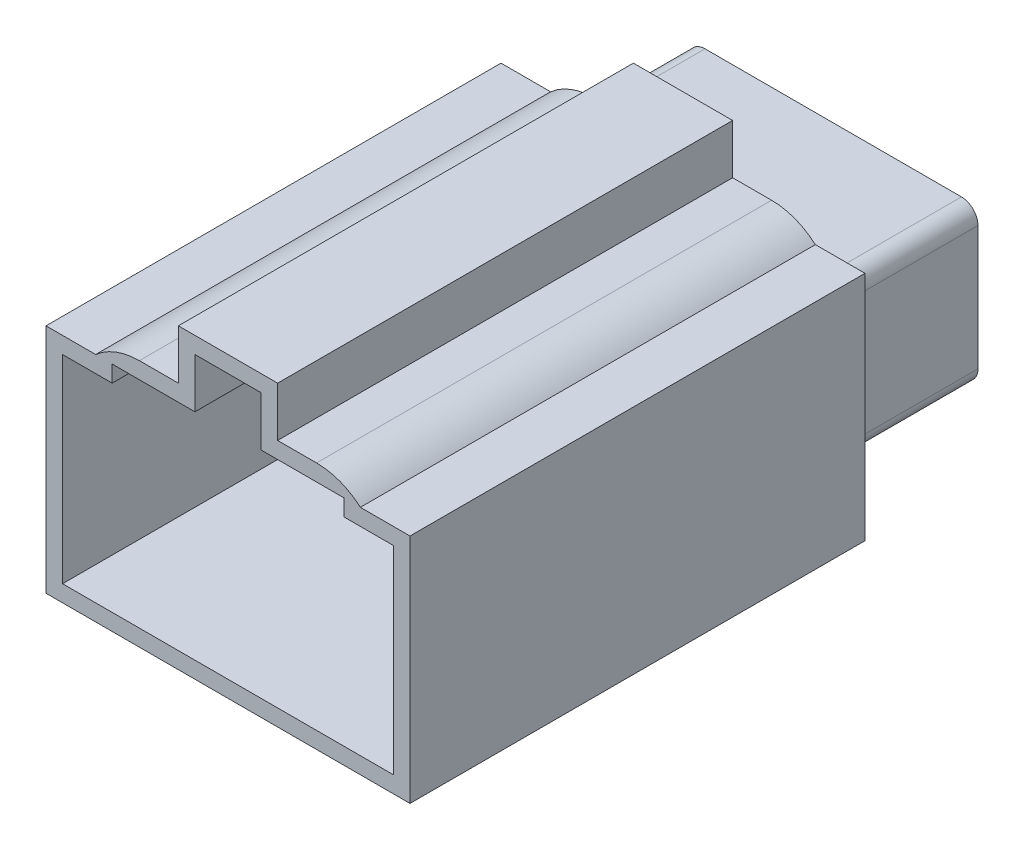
SolidWorks part; units mm, degrees
ref_plane "Front Plane" through (0, 0, 0) normal (0, 0, 1) x (1, 0, 0)
ref_plane "Top Plane" through (0, 0, 0) normal (0, 1, 0) x (1, 0, 0)
ref_plane "Right Plane" through (0, 0, 0) normal (1, 0, 0) x (0, 0, -1)
sketch "Sketch1" plane through (0, 0, 0) normal (0, 0, 1) x (1, 0, 0)
  line L0 (9.75, -11.1213) -> (-12.25, -11.1213)
  line L1 (-12.25, -11.1213) -> (-12.25, 2.8787)
  line L2 (-12.25, 2.8787) -> (-9.25, 2.8787)
  line L3 (-9.25, 2.8787) -> (-9.25, 3.8787)
  line L4 (-9.25, 3.8787) -> (-4.25, 3.8787)
  line L5 (-4.25, 3.8787) -> (-4.25, 6.8787)
  line L6 (-4.25, 6.8787) -> (1.75, 6.8787)
  line L7 (8.75, -10.1213) -> (-11.25, -10.1213)
  line L8 (1.75, 3.8787) -> (1.75, 6.8787)
  line L9 (6.75, 3.8787) -> (1.75, 3.8787)
  line L10 (6.75, 2.8787) -> (6.75, 3.8787)
  line L11 (9.75, 2.8787) -> (6.75, 2.8787)
  line L12 (9.75, -11.1213) -> (9.75, 2.8787)
  line L13 (-11.25, -10.1213) -> (-11.25, 1.8787)
  line L14 (-11.25, 1.8787) -> (-8.25, 1.8787)
  line L15 (-8.25, 1.8787) -> (-8.25, 2.8787)
  line L16 (-8.25, 2.8787) -> (-3.25, 2.8787)
  line L17 (-3.25, 2.8787) -> (-3.25, 5.8787)
  line L18 (-3.25, 5.8787) -> (0.75, 5.8787)
  line L19 (0.75, 2.8787) -> (0.75, 5.8787)
  line L20 (5.75, 2.8787) -> (0.75, 2.8787)
  line L21 (5.75, 1.8787) -> (5.75, 2.8787)
  line L22 (8.75, 1.8787) -> (5.75, 1.8787)
  line L23 (8.75, -10.1213) -> (8.75, 1.8787)
  point P17 (-1.25, -11.1213)
  dimension "D1" = 11
  dimension "D2" = 14
  dimension "D3" = 3
  dimension "D4" = 6
  dimension "D5" = 1
  dimension "D6" = 3
  dimension "D7" = 1
extrude "Boss-Extrude1" add sketch "Sketch1" along normal blind 27.5
fillet "Fillet2" radius 4 1 edges at (-9.25, 3.8787, 13.75)
fillet "Fillet4" radius 4 1 edges at (6.75, 3.8787, 13.75)
ref_plane "Plane1" through (0, 0, 10) normal (0, 0, -1) x (-1, 0, 0)
sketch "Sketch2" plane through (0, 0, 10) normal (0, 0, -1) x (-1, 0, 0)
  line L0 (-8.75, 1.8787) -> (11.25, 1.8787)
  line L1 (-8.75, -10.1213) -> (11.25, -10.1213)
  line L2 (-8.75, -10.1213) -> (-8.75, 1.8787)
  line L4 (11.25, -10.1213) -> (11.25, 1.8787)
  circle A0 centre (-3.75, -4.1213) radius 3
  circle A1 centre (6.25, -4.1213) radius 3
  point P0 (1.2901, -3.3456)
  dimension "D3" = 6
  dimension "D4" = 6
  dimension "D1" = 12
  dimension "D2" = 20
  dimension "D5" = 6
  dimension "D6" = 5
  dimension "D7" = 5
  dimension "D8" = 6
extrude "Boss-Extrude2" add sketch "Sketch2" along normal blind 5 contours L1 L4 L0 L2 A1 A0
sketch "Sketch3" plane through (0, 0, 10) normal (0, 0, -1) x (-1, 0, 0)
  line L1 (-7.5804, -8.7063) -> (9.9196, -8.7063)
  line L2 (-7.5804, -8.7063) -> (-7.5804, 0.7937)
  line L3 (-7.5804, 0.7937) -> (9.9196, 0.7937)
  line L4 (9.9196, -8.7063) -> (9.9196, 0.7937)
  line L5 (-7.5804, -8.7063) -> (9.9196, 0.7937) construction
  line L6 (-7.5804, 0.7937) -> (9.9196, -8.7063) construction
  line L7 (-7.0804, -8.0517) -> (9.4196, -8.0517)
  line L8 (-7.0804, -8.0517) -> (-7.0804, 0.1391)
  line L9 (-7.0804, 0.1391) -> (9.4196, 0.1391)
  line L10 (9.4196, -8.0517) -> (9.4196, 0.1391)
  line L11 (-7.0804, -8.0517) -> (9.4196, 0.1391) construction
  line L12 (-7.0804, 0.1391) -> (9.4196, -8.0517) construction
  circle A0 centre (-3.75, -4.1213) radius 3
  circle A1 centre (6.25, -4.1213) radius 3
  point P0 (1.1696, -3.9563)
  point P5 (1.1696, -3.9563)
  dimension "D1" = 6
  dimension "D2" = 6
  dimension "D3" = 17.5
  dimension "D4" = 9.5
  dimension "D5" = 16.5
extrude "Boss-Extrude4" add sketch "Sketch3" along normal blind 19 contours L1 L4 L3 L2 L10 L7 L8 L9 | A0
fillet "Fillet11" radius 1 4 edges at (7.5804, -8.7063, -2) (7.5804, 0.7937, -2) (-9.9196, -8.7063, -2) (-9.9196, 0.7937, -2)
